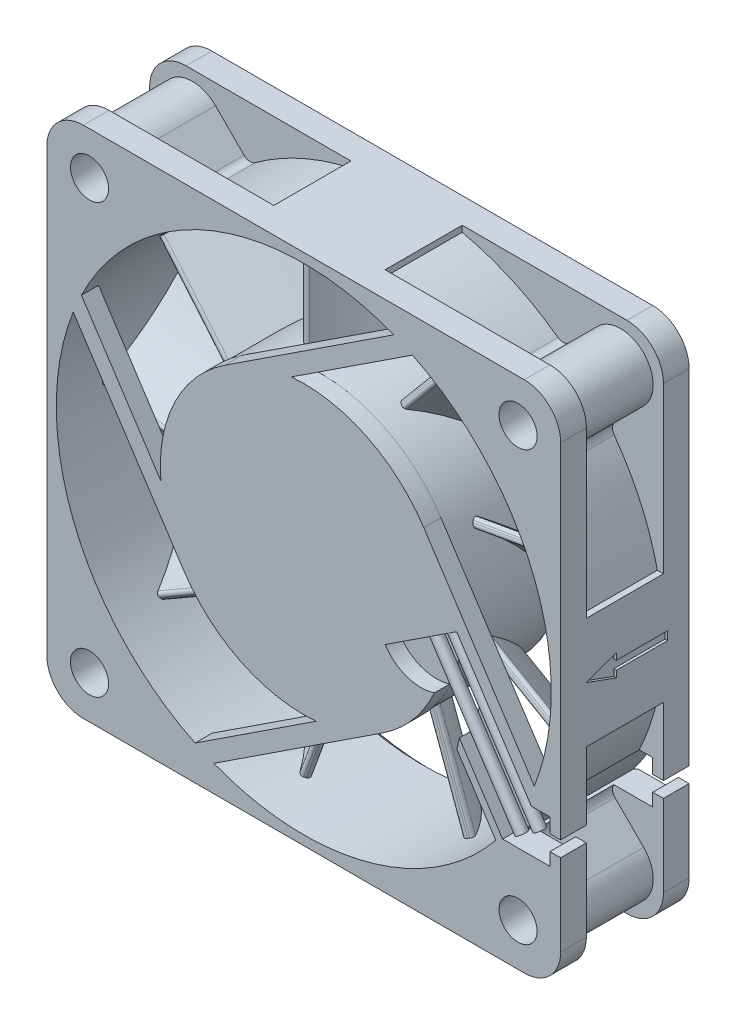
SolidWorks part; units mm, degrees
ref_plane "Front" through (0, 0, 0) normal (0, 0, 1) x (1, 0, 0)
ref_plane "Top" through (0, 0, 0) normal (0, 1, 0) x (1, 0, 0)
ref_plane "Side" through (0, 0, 0) normal (1, 0, 0) x (0, 0, -1)
sketch "Sketch1" plane through (0, 0, 0) normal (0, 0, 1) x (1, 0, 0)
  line L0 (-30, 30) -> (30, 30)
  line L1 (30, 30) -> (30, -30)
  line L2 (30, -30) -> (-30, -30)
  line L3 (-30, -30) -> (-30, 30)
  dimension "D1" = 60
  dimension "D3" = 60
  dimension "D4" = 30
  dimension "D5" = 30
extrude "Inside Base" add sketch "Sketch1" along normal blind 3
sketch "Sketch2" plane through (0, 0, 0) normal (0, 0, -1) x (-1, 0, 0)
  line L0 (30, -30) -> (30, 30) construction
  line L1 (0, 0) -> (0, 30) construction
  line L2 (0, 0) -> (30, 0) construction
  line L3 (0, 0) -> (30, 30) construction
  line L4 (24.343, 18.9689) -> (27.687, 22.313)
  line L5 (18.9689, 24.343) -> (22.313, 27.687)
  line L6 (30, 30) -> (-30, 30) construction
  line L7 (30, -30) -> (30, 30) construction
  line L8 (6.5, 30) -> (6.5, 29.2874)
  line L9 (30, 6.5) -> (29.2874, 6.5)
  line L10 (30, -6.5) -> (30, 6.5)
  line L11 (-6.5, 30) -> (6.5, 30)
  line L12 (-6.5, -30) -> (6.5, -30)
  line L13 (30, -6.5) -> (29.2874, -6.5)
  line L14 (6.5, -30) -> (6.5, -29.2874)
  line L15 (18.9689, -24.343) -> (22.313, -27.687)
  line L16 (24.343, -18.9689) -> (27.687, -22.313)
  line L17 (-24.343, -18.9689) -> (-27.687, -22.313)
  line L18 (-18.9689, -24.343) -> (-22.313, -27.687)
  line L19 (-6.5, -30) -> (-6.5, -29.2874)
  line L20 (-30, -6.5) -> (-29.2874, -6.5)
  line L21 (-30, -6.5) -> (-30, 6.5)
  line L22 (-30, 6.5) -> (-29.2874, 6.5)
  line L23 (-6.5, 30) -> (-6.5, 29.2874)
  line L24 (-18.9689, 24.343) -> (-22.313, 27.687)
  line L25 (-24.343, 18.9689) -> (-27.687, 22.313)
  arc A0 (17.6727, 24.242) -> (6.5, 29.2874) centre (0, 0) ccw
  arc A1 (27.687, 22.313) -> (22.313, 27.687) centre (25, 25) ccw
  arc A2 (29.2874, 6.5) -> (24.242, 17.6727) centre (0, 0) ccw
  arc A3 (17.6727, 24.242) -> (18.9689, 24.343) centre (18.2618, 25.0501) ccw
  arc A4 (24.242, 17.6727) -> (24.343, 18.9689) centre (25.0501, 18.2618) cw
  arc A5 (24.242, -17.6727) -> (24.343, -18.9689) centre (25.0501, -18.2618) ccw
  arc A6 (17.6727, -24.242) -> (18.9689, -24.343) centre (18.2618, -25.0501) cw
  arc A7 (29.2874, -6.5) -> (24.242, -17.6727) centre (0, 0) cw
  arc A8 (27.687, -22.313) -> (22.313, -27.687) centre (25, -25) cw
  arc A9 (17.6727, -24.242) -> (6.5, -29.2874) centre (0, 0) cw
  arc A10 (-17.6727, -24.242) -> (-6.5, -29.2874) centre (0, 0) ccw
  arc A11 (-27.687, -22.313) -> (-22.313, -27.687) centre (-25, -25) ccw
  arc A12 (-29.2874, -6.5) -> (-24.242, -17.6727) centre (0, 0) ccw
  arc A13 (-17.6727, -24.242) -> (-18.9689, -24.343) centre (-18.2618, -25.0501) ccw
  arc A14 (-24.242, -17.6727) -> (-24.343, -18.9689) centre (-25.0501, -18.2618) cw
  arc A15 (-24.242, 17.6727) -> (-24.343, 18.9689) centre (-25.0501, 18.2618) ccw
  arc A16 (-17.6727, 24.242) -> (-18.9689, 24.343) centre (-18.2618, 25.0501) cw
  arc A17 (-29.2874, 6.5) -> (-24.242, 17.6727) centre (0, 0) cw
  arc A18 (-27.687, 22.313) -> (-22.313, 27.687) centre (-25, 25) cw
  arc A19 (-17.6727, 24.242) -> (-6.5, 29.2874) centre (0, 0) cw
  circle A20 centre (0, 0) radius 28.9
  point P41 (0, -30)
  dimension "D4" = 6.5
  dimension "D6" = 1
  dimension "D7" = 57.8
  dimension "D1" = 3.8
  dimension "D2" = 3.8
  dimension "D3" = 25
  dimension "D5" = 6.5
extrude "Center Boss" add sketch "Sketch2" along normal blind 9
sketch "Sketch3" plane through (0, 0, -9) normal (0, 0, -1) x (-1, 0, 0)
  line L4 (30, 30) -> (-30, 30)
  line L5 (-30, 30) -> (-30, -30)
  line L6 (-30, -30) -> (30, -30)
  line L7 (30, -30) -> (30, 30)
  line L8 (30, 30) -> (-30, 30)
  line L9 (-30, 30) -> (-30, -30)
  line L10 (-30, -30) -> (30, -30)
  line L11 (30, -30) -> (30, 30)
  dimension "D1" = 0
extrude "Outside Boss" add sketch "Sketch3" along normal blind 3
sketch "Sketch4" plane through (0, 0, -12) normal (0, 0, -1) x (-1, 0, 0)
  circle A0 centre (0, 0) radius 28.9 construction
  circle A1 centre (0, 0) radius 28.9
extrude "Thru Dia Cut" cut sketch "Sketch4" against normal through all
fillet "Fillet1" radius 4.25 8 edges at (-30, -30, -10.5) (-30, 30, -10.5) (30, 30, -10.5) (30, -30, -10.5) (-30, -30, 1.5) (30, -30, 1.5) (30, 30, 1.5) (-30, 30, 1.5)
sketch "Sketch5" plane through (0, 0, -12) normal (0, 0, -1) x (-1, 0, 0)
  line L0 (0, 0) -> (0, -30) construction
  line L1 (0, 0) -> (30, 0) construction
  line L2 (30, -25.75) -> (30, 25.75) construction
  line L3 (-25.75, -30) -> (25.75, -30) construction
  circle A0 centre (25.02, -25.02) radius 2.225
  circle A1 centre (25.02, 25.02) radius 2.225
  circle A2 centre (-25.02, 25.02) radius 2.225
  circle A3 centre (-25.02, -25.02) radius 2.225
  dimension "D1" = 4.45
  dimension "D2" = 25.02
  dimension "D3" = 25.02
extrude "Mnt Holes Cut" cut sketch "Sketch5" against normal through all
sketch "Sketch10" plane through (0, 0, 3) normal (0, 0, 1) x (1, 0, 0)
  line L0 (-9.1849, 14.0072) -> (10.5096, 26.9213)
  line L1 (-1.4506, 16.6871) -> (12.6947, 25.9625)
  line L3 (-14.0072, -9.1849) -> (-26.9213, 10.5096)
  line L4 (-16.6871, -1.4506) -> (-25.9625, 12.6947)
  line L5 (9.1849, -14.0072) -> (-10.5096, -26.9213)
  line L6 (1.4506, -16.6871) -> (-12.6947, -25.9625)
  line L7 (14.0072, 9.1849) -> (26.9213, -10.5096)
  line L8 (15.1492, -7.146) -> (22.4207, -18.2352)
  line L11 (0, 0) -> (30, 0) construction
  line L12 (30, 25.75) -> (30, -25.75) construction
  line L14 (16.6871, 1.4506) -> (17.6383, 0)
  arc A0 (14.0072, 9.1849) -> (-1.4506, 16.6871) centre (0, 0) ccw
  arc A2 (12.6947, 25.9625) -> (10.5096, 26.9213) centre (0, 0) ccw
  arc A3 (-9.1849, 14.0072) -> (-16.6871, -1.4506) centre (0, 0) ccw
  arc A4 (-14.0072, -9.1849) -> (1.4506, -16.6871) centre (0, 0) ccw
  arc A5 (9.1849, -14.0072) -> (15.1492, -7.146) centre (0, 0) ccw
  arc A6 (-25.9625, 12.6947) -> (-26.9213, 10.5096) centre (0, 0) ccw
  arc A7 (-12.6947, -25.9625) -> (-10.5096, -26.9213) centre (0, 0) ccw
  arc A8 (22.4207, -18.2352) -> (26.9213, -10.5096) centre (0, 0) ccw
  circle A12 centre (0, 0) radius 28.9 construction
  dimension "D1" = 33.5
  dimension "D3" = 33.254
  dimension "D4" = 8
  dimension "D2" = 2
extrude "Inside Frame Boss" add sketch "Sketch10" against normal blind 2
sketch "Sketch8" plane through (0, 0, 3) normal (0, 0, 1) x (1, 0, 0)
  circle A0 centre (0, 0) radius 16.65
  dimension "D1" = 33.3
extrude "Fan Motor Body" add sketch "Sketch8" against normal blind 14
sketch "Sketch9" plane through (0, 0, 0) normal (0, 1, 0) x (1, 0, 0)
  line L0 (-5, 2) -> (5, 10.5) construction
  line L3 (0, 0) -> (0, 16) construction
  line L6 (0, 2) -> (-31.7402, 2) construction
  line L8 (16.65, 10.5) -> (-16.65, 10.5) construction
  line L10 (-25.75, -3) -> (25.75, -3) construction
  arc A0 (5, 10.5) -> (-5, 2) centre (15.6235, -12.1306) ccw
  dimension "D5" = 50
  dimension "D1" = 5
  dimension "D2" = 5
  dimension "D3" = 5
  dimension "D4" = 8.5
extrude "Fan Blade 1" add sketch "Sketch9" along normal blind 28 thin
fillet "Blade Radius" radius 0.4 8 edges at (0.0705, 16.6499, -6.7997) (-5.0017, 15.881, -2.0012) (0.4295, 16.6445, -8.3486) (5.0004, 15.8814, -10.499) (5.2125, 21.9065, -10.0474) (4.7875, 21.9734, -10.9526) (-5.4125, 21.8729, -2.2826) (-4.5875, 22.0028, -1.7174)
pattern_circular "Blade Pattern" count 9 every 40 about axis through (0, 0, 0) along (0, 0, 1) of "Blade Radius", "Fan Blade 1"
fillet "Fillet2" radius 0.5 1 edges at (16.65, 0, -11)
chamfer "Chamfer1" distance 1 angle 45 1 edges at (-28.9, 0, -12)
sketch "Sketch11" plane through (0, 0, 3) normal (0, 0, 1) x (1, 0, 0)
  line L0 (30, -14.4143) -> (30, -16.2143)
  line L1 (17.8597, 0.5742) -> (9.4972, -4.9093)
  line L2 (25.667, -11.3321) -> (12.7528, 8.3623)
  line L3 (26.5733, -12.7143) -> (17.8597, 0.5742)
  line L4 (30, -14.4143) -> (28.75, -14.4143)
  line L5 (15.9436, -6.625) -> (23.2151, -17.7143)
  line L6 (15.9436, -6.625) -> (23.2151, -17.7143)
  line L7 (23.2151, -17.7143) -> (28.75, -17.7143)
  line L8 (28.75, -17.7143) -> (28.75, -16.2143)
  line L9 (28.75, -16.2143) -> (30, -16.2143)
  line L10 (28.75, -14.4143) -> (28.75, -12.7143)
  line L11 (28.75, -12.7143) -> (26.5733, -12.7143)
  line L12 (30, 25.75) -> (30, -25.75) construction
  arc A2 (9.4972, -4.9093) -> (15.9436, -6.625) centre (13.6784, -2.1676) ccw
  dimension "D7" = 10
  dimension "D3" = 1.8
  dimension "D4" = 5
  dimension "D5" = 1.25
  dimension "D6" = 1.5
  dimension "D1" = 1.5
  dimension "D2" = 0.95
extrude "Wire Channel Cut1" cut sketch "Sketch11" against normal blind 1.8
sketch "Sketch12" plane through (0, 0, 3) normal (0, 0, 1) x (1, 0, 0)
  line L0 (19.7623, -2.3273) -> (17.8909, -11.3272)
  line L2 (15.1492, -7.146) -> (22.4207, -18.2352) construction
  line L3 (15.1492, -7.146) -> (17.8909, -11.3272)
  line L9 (15.9436, -6.625) -> (23.2151, -17.7143)
  line L10 (23.2151, -17.7143) -> (28.75, -17.7143)
  line L11 (28.75, -17.7143) -> (28.75, -16.2143)
  line L12 (28.75, -16.2143) -> (30, -16.2143)
  line L13 (30, -16.2143) -> (30, -14.4143)
  line L14 (30, -14.4143) -> (28.75, -14.4143)
  line L15 (28.75, -14.4143) -> (28.75, -12.7143)
  line L16 (28.75, -12.7143) -> (26.5733, -12.7143)
  line L17 (26.5733, -12.7143) -> (17.8597, 0.5742)
  line L19 (23.7766, -17.7143) -> (28.75, -17.7143)
  line L20 (28.75, -17.7143) -> (28.75, -16.2143)
  line L21 (28.75, -16.2143) -> (30, -16.2143)
  line L22 (30, -16.2143) -> (30, -14.4143)
  line L23 (30, -14.4143) -> (28.75, -14.4143)
  line L24 (28.75, -14.4143) -> (28.75, -12.7143)
  line L25 (28.75, -12.7143) -> (26.7856, -12.7143)
  line L26 (19.7623, -2.3273) -> (17.8597, 0.5742)
  line L31 (17.8597, 0.5742) -> (9.4972, -4.9093)
  line L32 (17.8597, 0.5742) -> (16.7493, -0.1539)
  arc A0 (9.1849, -14.0072) -> (15.1492, -7.146) centre (0, 0) ccw construction
  arc A1 (9.4972, -4.9093) -> (15.9436, -6.625) centre (13.6784, -2.1676) ccw
  arc A3 (15.1492, -7.146) -> (16.7493, -0.1539) centre (0, 0) ccw
  arc A4 (-10.5096, -26.9213) -> (22.4207, -18.2352) centre (0, 0) ccw construction
  arc A5 (23.0396, -17.4466) -> (26.2142, -12.1666) centre (0, 0) ccw construction
  arc A6 (23.7766, -17.7143) -> (26.7856, -12.7143) centre (0, 0) ccw
  dimension "D3" = 5
  dimension "D4" = 45
  dimension "D1" = 0
  dimension "D2" = 0.75
extrude "Wire Channel Cut" cut sketch "Sketch12" against normal up to next
sketch "Sketch16" plane through (30, 0, 0) normal (1, 0, 0) x (0, 0, -1)
  line L0 (4.5, 6.5) -> (4.5, -6.5) construction
  line L1 (9, 6.5) -> (0, 6.5) construction
  line L2 (9, -6.5) -> (0, -6.5) construction
  line L3 (4.5, 0) -> (12.078, 0) construction
  line L4 (9, 0) -> (0, 0) construction
  line L5 (0, 0) -> (3.5, 1.2739)
  line L6 (3.5, 1.2739) -> (3.5, 0.5)
  line L7 (3.5, 0.5) -> (9.5, 0.5)
  line L8 (9.5, 0.5) -> (9.5, -0.5)
  line L10 (3.5, -0.5) -> (9.5, -0.5)
  line L11 (3.5, -1.2739) -> (3.5, -0.5)
  line L12 (0, 0) -> (3.5, -1.2739)
  point P16 (9.5, 0)
  dimension "D1" = 0.5
  dimension "D2" = 5
  dimension "D3" = 1
  dimension "D4" = 20
extrude "Flow Arrow" cut sketch "Sketch16" against normal blind 0.3
sketch "Sketch17" plane through (5.1069, -7.7882, 0) normal (0.5483, -0.8362, 0) x (0.8362, 0.5483, 0)
  line L0 (15.25, 1) -> (15.25, 3) construction
  line L1 (15.25, 3) -> (5.25, 3) construction
  circle A0 centre (14, 2.25) radius 0.625
  circle A1 centre (11.5, 2.25) radius 0.625
  dimension "D3" = 1.25
  dimension "D1" = 1.25
  dimension "D2" = 2.5
  dimension "D4" = 0.75
extrude "Wires" add sketch "Sketch17" along normal blind 18.25
equation "\"D2@Sketch5\" = \"D3@Sketch5\""
equation "\"D3@Sketch1\" = \"D1@Sketch1\""
equation "\"D5@Sketch1\" = \"D4@Sketch1\""
equation "\"D4@Sketch1\" = 0.5 * \"D1@Sketch1\""
